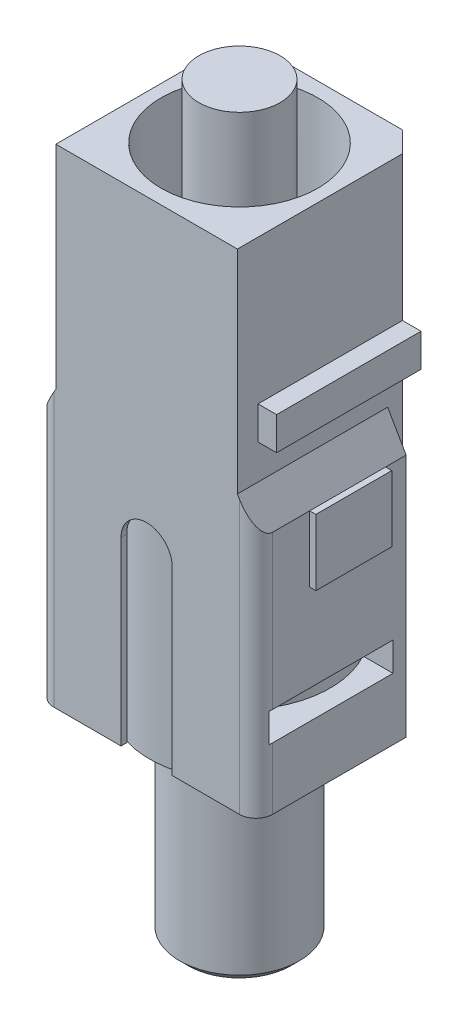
SolidWorks part; units mm, degrees
ref_plane "Top" through (0, 0, 0) normal (0, 0, 1) x (1, 0, 0)
ref_plane "Front" through (0, 0, 0) normal (0, 1, 0) x (1, 0, 0)
ref_plane "Side" through (0, 0, 0) normal (1, 0, 0) x (0, 0, -1)
sketch "Sketch1" plane through (0, 0, 0) normal (0, 1, 0) x (1, 0, 0)
  line L0 (2.794, 2.8575) -> (-2.794, -2.8575) construction
  line L1 (-2.794, -2.8575) -> (2.794, -2.8575)
  line L2 (-2.794, -2.8575) -> (-2.794, 2.8575)
  line L3 (-2.794, 2.8575) -> (2.794, 2.8575)
  line L4 (2.794, -2.8575) -> (2.794, 2.8575)
  dimension "D1" = 5.588
  dimension "D2" = 5.715
extrude "Base-Extrude" add sketch "Sketch1" along normal mid plane 15.0368
chamfer "Chamfer1" distance 0.635 angle 45
ref_plane "Plane4" through (0, 2.0574, 0) normal (0, 1, 0) x (-1, 0, 0)
sketch "Sketch2" plane through (0, 2.0574, 0) normal (0, 1, 0) x (-1, 0, 0)
  line L1 (2.794, -2.2225) -> (3.3655, -2.2225)
  line L2 (2.794, -2.2225) -> (2.794, 2.2225)
  line L3 (2.794, 2.2225) -> (3.3655, 2.2225)
  line L4 (3.3655, -2.2225) -> (3.3655, 2.2225)
  line L5 (-2.794, 2.2225) -> (-3.3655, 2.2225)
  line L6 (-2.794, 2.2225) -> (-2.794, -2.2225)
  line L7 (-2.794, -2.2225) -> (-3.3655, -2.2225)
  line L8 (-3.3655, 2.2225) -> (-3.3655, -2.2225)
  line L9 (-2.794, 2.8575) -> (-2.794, -2.2225) construction
  line L10 (2.794, -2.2225) -> (2.794, 2.8575) construction
  dimension "D1" = 6.731
  dimension "D2" = 0.635
extrude "Boss-Extrude1" add sketch "Sketch2" along normal blind 1.016
sketch "Sketch3" plane through (0, 0, 2.8575) normal (0, 0, 1) x (1, 0, 0)
  line L0 (-2.794, -7.5184) -> (2.794, -7.5184) construction
  line L1 (-2.794, 7.5184) -> (-2.794, -7.5184) construction
  line L2 (-2.794, 0.9906) -> (-3.3655, 0)
  line L3 (-3.3655, 0) -> (-3.3655, -7.5184)
  line L4 (0, 0) -> (0, -7.8264) construction
  line L5 (-2.794, 0.9906) -> (-2.794, -7.5184)
  line L6 (-3.3655, -7.5184) -> (-2.794, -7.5184)
  line L7 (2.794, 0.9906) -> (2.794, -7.5184)
  line L8 (3.3655, 0) -> (3.3655, -7.5184)
  line L9 (2.794, 0.9906) -> (3.3655, 0)
  line L10 (2.794, -7.5184) -> (3.3655, -7.5184)
  line L11 (-3.3655, 2.0574) -> (-2.794, 2.0574) construction
  dimension "D1" = 6.731
  dimension "D2" = 1.0668
extrude "Boss-Extrude2" add sketch "Sketch3" against normal blind 4.6228
sketch "Sketch4" plane through (0, 0, 2.8575) normal (0, 0, 1) x (1, 0, 0)
  line L0 (0.7874, -1.9558) -> (0.7874, -7.5184)
  line L1 (-0.7874, -1.9558) -> (-0.7874, -7.5184)
  line L2 (-3.3655, -7.5184) -> (3.3655, -7.5184) construction
  line L3 (-0.7874, -7.5184) -> (0.7874, -7.5184)
  arc A0 (0.7874, -1.9558) -> (-0.7874, -1.9558) centre (0, -1.9558) ccw
  dimension "D2" = 6.35
  dimension "D1" = 1.5748
extrude "Cut-Extrude1" cut sketch "Sketch4" against normal through all
sketch "Sketch5" plane through (3.3655, 0, 0) normal (1, 0, 0) x (0, 0, -1)
  line L0 (-0.5461, -7.5184) -> (-0.5461, -3.4227) construction
  line L1 (1.3589, -4.7244) -> (-2.4511, -4.7244)
  line L2 (1.3589, -4.7244) -> (1.3589, -5.6134)
  line L3 (1.3589, -5.6134) -> (-2.4511, -5.6134)
  line L4 (-2.4511, -4.7244) -> (-2.4511, -5.6134)
  line L5 (1.7653, -7.5184) -> (-2.8575, -7.5184) construction
  dimension "D1" = 3.81
  dimension "D2" = 0.889
  dimension "D3" = 1.905
extrude "Cut-Extrude2" cut sketch "Sketch5" against normal through all
sketch "Sketch6" plane through (0, 7.5184, 0) normal (0, 1, 0) x (-1, 0, 0)
  circle A0 centre (0, 0) radius 2.413
  dimension "D1" = 4.826
extrude "Cut-Extrude3" cut sketch "Sketch6" against normal up to surface
sketch "Sketch7" plane through (0, -7.5184, 0) normal (0, -1, 0) x (1, 0, 0)
  circle A0 centre (0, 0) radius 2.794
  dimension "D1" = 5.588
extrude "Cut-Extrude4" cut sketch "Sketch7" against normal blind 6.35
sketch "Sketch8" plane through (0, 3.0734, 0) normal (0, 1, 0) x (-1, 0, 0)
  circle A0 centre (0, 0) radius 1.251
  dimension "D1" = 2.5019
extrude "Boss-Extrude3" add sketch "Sketch8" along normal offset from surface 1.7018
sketch "Sketch9" plane through (0, 0, 0) normal (0, 0, 1) x (1, 0, 0)
  line L0 (0, 0.9722) -> (2.7686, 0.9722)
  line L1 (2.7686, 0.9722) -> (2.7686, -7.5184)
  line L2 (2.7686, -7.5184) -> (1.8415, -7.5184)
  line L3 (1.8415, -7.5184) -> (1.8415, -13.6144)
  line L4 (1.8415, -13.6144) -> (0, -13.6144)
  line L5 (0, -13.6144) -> (0, 0.9722)
  line L7 (0, 0) -> (0, 4.1324) construction
  line L8 (0.7874, -7.5184) -> (3.3655, -7.5184) construction
  line L9 (0, 3.0734) -> (0, 7.5184) construction
  dimension "D1" = 6.096
  dimension "D2" = 1.8415
  dimension "D3" = 2.7686
revolve "Boss-Revolve2" add sketch "Sketch9" angle 360 about L7
sketch "Sketch10" plane through (3.3655, 0, 0) normal (1, 0, 0) x (0, 0, -1)
  line L0 (1.7653, 0) -> (-2.8575, 0) construction
  line L1 (1.1303, -2.032) -> (-1.2065, -2.032)
  line L2 (1.1303, -2.032) -> (1.1303, 0)
  line L3 (1.1303, 0) -> (-1.2065, 0)
  line L4 (-1.2065, -2.032) -> (-1.2065, 0)
  line L5 (-2.8575, -7.5184) -> (-2.8575, 0) construction
  dimension "D1" = 2.3368
  dimension "D2" = 1.651
  dimension "D3" = 2.032
extrude "Boss-Extrude4" add sketch "Sketch10" along normal blind 0.1905
mirror "Mirror1" about plane through (0, 0, 0) normal (1, 0, 0)
fillet "Fillet1" radius 0.508
chamfer "Chamfer2" distance 0.254 angle 45
